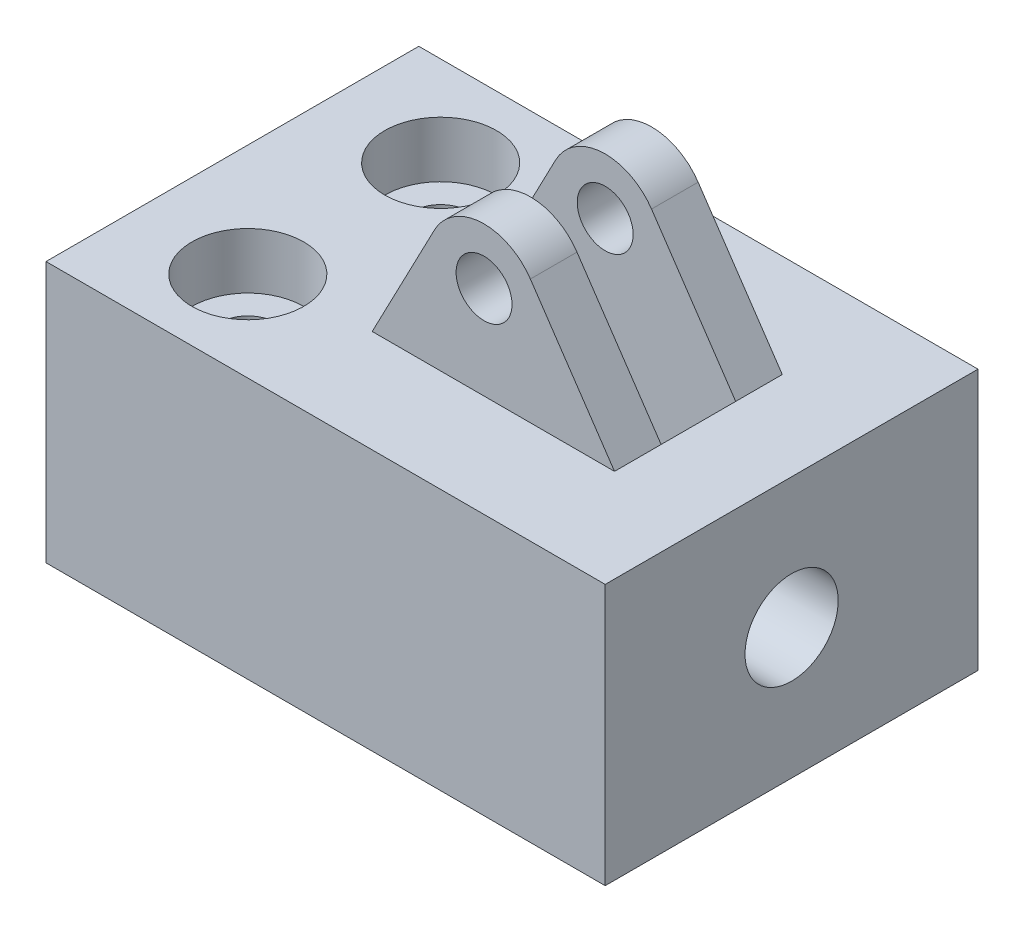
SolidWorks part; units mm, degrees
ref_plane "前视基准面" through (0, 0, 0) normal (0, 0, 1) x (1, 0, 0)
ref_plane "上视基准面" through (0, 0, 0) normal (0, 1, 0) x (1, 0, 0)
ref_plane "右视基准面" through (0, 0, 0) normal (1, 0, 0) x (0, 0, -1)
sketch "草图1" plane through (0, 0, 0) normal (0, 0, 1) x (1, 0, 0)
  line L0 (0, 0) -> (79.8859, 0) construction
  line L1 (0, 0) -> (0, 77.0759) construction
  line L3 (-30, 14) -> (30, 14)
  line L4 (-30, 14) -> (-30, -14)
  line L5 (-30, -14) -> (30, -14)
  line L6 (30, 14) -> (30, -14)
extrude "拉伸1" add sketch "草图1" against normal mid plane 40
sketch "草图2" plane through (-30, 0, 0) normal (-1, 0, 0) x (0, 0, 1)
  circle A0 centre (0, 0) radius 6
extrude "切除-拉伸1" cut sketch "草图2" against normal blind 16
sketch "草图3" plane through (-14, 0, 0) normal (-1, 0, 0) x (0, 0, 1)
  circle A0 centre (0, 0) radius 5
extrude "切除-拉伸2" cut sketch "草图3" against normal through all
sketch "草图4" plane through (0, 14, 0) normal (0, 1, 0) x (1, 0, 0)
  line L0 (0, 0) -> (-32.6628, 0) construction
  line L1 (-30, 20) -> (-30, -20) construction
  circle A0 centre (-18, 10.3448) radius 6
  circle A1 centre (-18, -10.3448) radius 6
  dimension "D1" = 12
extrude "切除-拉伸3" cut sketch "草图4" against normal blind 6
sketch "草图5" plane through (0, 8, 0) normal (0, 1, 0) x (1, 0, 0)
  line L0 (0, 0) -> (-32.2797, 0) construction
  circle A0 centre (-18, -10.3448) radius 3
  circle A1 centre (-18, 10.3448) radius 3
extrude "切除-拉伸4" cut sketch "草图5" against normal through all
ref_plane "基准面1" through (0, 0, 4) normal (0, 0, 1) x (1, 0, 0)
sketch "草图6" plane through (0, 0, 4) normal (0, 0, 1) x (1, 0, 0)
  line L0 (-30, 14) -> (-30, -14) construction
  line L1 (0.6831, 26.7803) -> (-6, 14)
  line L2 (30, 14) -> (-30, 14) construction
  line L3 (10.9712, 27.3597) -> (20, 14)
  line L4 (20, 14) -> (-6, 14)
  circle A0 centre (6, 24) radius 3
  arc A1 (10.9712, 27.3597) -> (0.6831, 26.7803) centre (6, 24) ccw
  dimension "D2" = 24
  dimension "D1" = 36
  dimension "D3" = 10
extrude "拉伸2" add sketch "草图6" along normal blind 5
mirror "镜向1" about plane through (0, 0, 0) normal (0, 0, 1) of "拉伸2"
sketch "草图7" plane through (0, 0, 0) normal (0, 0, 1) x (1, 0, 0)
  line L0 (-6, 14) -> (-6, 4)
  line L1 (20, 14) -> (26.7583, 4)
  line L2 (26.7583, 4) -> (-6, 4)
  line L3 (20, 14) -> (10.9712, 27.3597) construction
  line L4 (20, 14) -> (-6, 14)
extrude "切除-拉伸5" cut sketch "草图7" against normal mid plane 8
sketch "草图8" plane through (0, 0, -20) normal (0, 0, -1) x (-1, 0, 0)
  line L0 (-6, 24) -> (-6, -5.8027) construction
  circle A0 centre (-6, 0) radius 2.5
extrude "切除-拉伸6" cut sketch "草图8" against normal up to surface (15 mm away)
